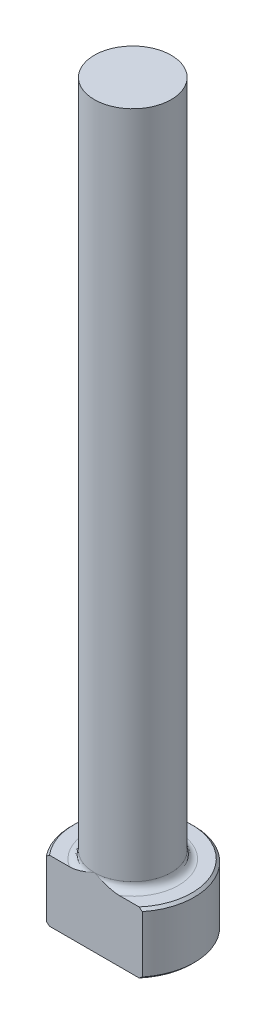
SolidWorks part; units mm, degrees
ref_plane "Front Plane" through (0, 0, 0) normal (0, 0, 1) x (1, 0, 0)
ref_plane "Top Plane" through (0, 0, 0) normal (0, 1, 0) x (1, 0, 0)
ref_plane "Right Plane" through (0, 0, 0) normal (1, 0, 0) x (0, 0, -1)
sketch "Sketch1" plane through (0, 0, 0) normal (0, 0, 1) x (1, 0, 0)
  line L0 (0, 259.9588) -> (0, -15.1925) construction
  line L1 (0, 0) -> (-6.35, 0)
  line L2 (-6.35, 0) -> (-6.35, 6.35)
  line L3 (-6.35, 6.35) -> (-3.9687, 6.35)
  line L4 (-3.9687, 6.35) -> (-3.9687, 76.2)
  line L5 (-3.9687, 76.2) -> (0, 76.2)
  line L6 (0, 76.2) -> (0, 0)
  dimension "L" = 76.2
  dimension "H" = 12.7
  dimension "T" = 6.35
  dimension "D" = 7.9375
revolve "Revolve1" add sketch "Sketch1" angle 360 about L0
chamfer "Chamfer1" distance 0.254 angle 45 2 edges at (0, 6.35, 6.35) (0, 0, 6.35)
fillet "Fillet1" radius 0.762 1 edges at (0, 6.35, 3.9687)
sketch "Sketch2" plane through (0, 0, 0) normal (0, 1, 0) x (1, 0, 0)
  line L0 (-4.957, -3.9687) -> (4.957, -3.9687)
  circle A0 centre (0, 0) radius 6.35 construction
  arc A1 (-4.957, -3.9687) -> (4.957, -3.9687) centre (0, 0) ccw
  circle A3 centre (0, 0) radius 3.9687 construction
  dimension "D1" = 0
extrude "Key" cut sketch "Sketch2" along normal through all
sketch "Pocket Sketch" plane through (0, 0, 0) normal (0, 0, 1) x (1, 0, 0)
  line L0 (-6.7469, 0) -> (-6.7469, 6.3754)
  line L1 (-6.7469, 6.3754) -> (-5.1276, 6.3754)
  line L2 (-4.3656, 7.1374) -> (-4.3656, 22.225)
  line L3 (-4.3656, 22.225) -> (0, 22.225)
  line L4 (0, 22.225) -> (0, 0)
  line L5 (0, 0) -> (-6.7469, 0)
  line L6 (0, 12.6104) -> (0, -2.4989) construction
  line L7 (-6.35, 6.096) -> (-6.35, 0.254) construction
  line L8 (6.096, 6.35) -> (-6.096, 6.35) construction
  line L9 (-3.9687, 76.2) -> (-3.9687, 7.112) construction
  line L10 (-5.1276, 6.3754) -> (-4.3656, 7.1374)
  point P3 (-4.3656, 6.3754)
  dimension "D1" = 13.4937
  dimension "D2" = 0.3969
  dimension "D3" = 0.0254
  dimension "D4" = 0.3969
  dimension "D5" = 8.7312
  dimension "D6" = 22.225
